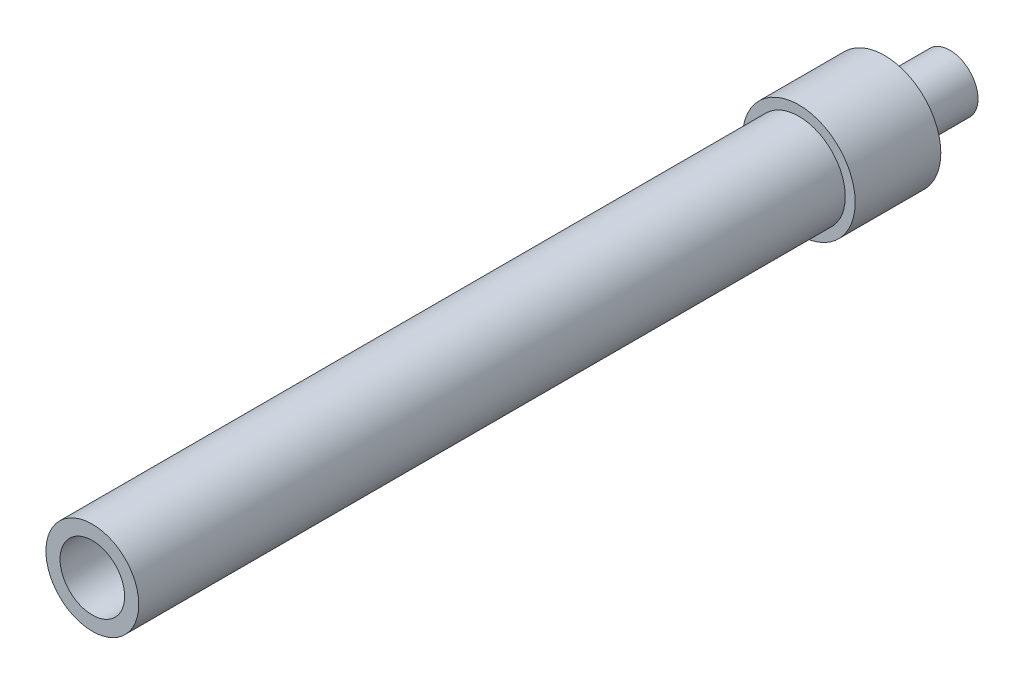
SolidWorks part; units mm, degrees
ref_plane "Front" through (0, 0, 0) normal (0, 0, 1) x (1, 0, 0)
ref_plane "Top" through (0, 0, 0) normal (0, 1, 0) x (1, 0, 0)
ref_plane "Right" through (0, 0, 0) normal (1, 0, 0) x (0, 0, -1)
sketch "Sketch1" plane through (0, 0, 0) normal (0, 0, 1) x (1, 0, 0)
  circle A0 centre (0, 0) radius 5.2324
  circle A1 centre (0, 0) radius 3.6385
  dimension "D1" = 10.4648
  dimension "D2" = 7.2771
extrude "Extrude1" add sketch "Sketch1" along normal blind 89.281
sketch "Sketch2" plane through (0, 0, 0) normal (0, 0, 1) x (1, 0, 0)
  circle A0 centre (0, 0) radius 6.35
  dimension "D1" = 12.7
extrude "Extrude2" add sketch "Sketch2" along normal blind 9.652
sketch "Sketch3" plane through (0, 0, 0) normal (0, 0, -1) x (-1, 0, 0)
  circle A0 centre (0, 0) radius 3.175
  dimension "D1" = 6.35
extrude "Extrude3" add sketch "Sketch3" along normal blind 7.366
sketch "Sketch5" plane through (0, 0, -7.366) normal (0, 0, -1) x (-1, 0, 0)
  circle A0 centre (0, 0) radius 0.9652
  dimension "D1" = 1.9304
extrude "Cut-Extrude1" cut sketch "Sketch5" against normal through all
